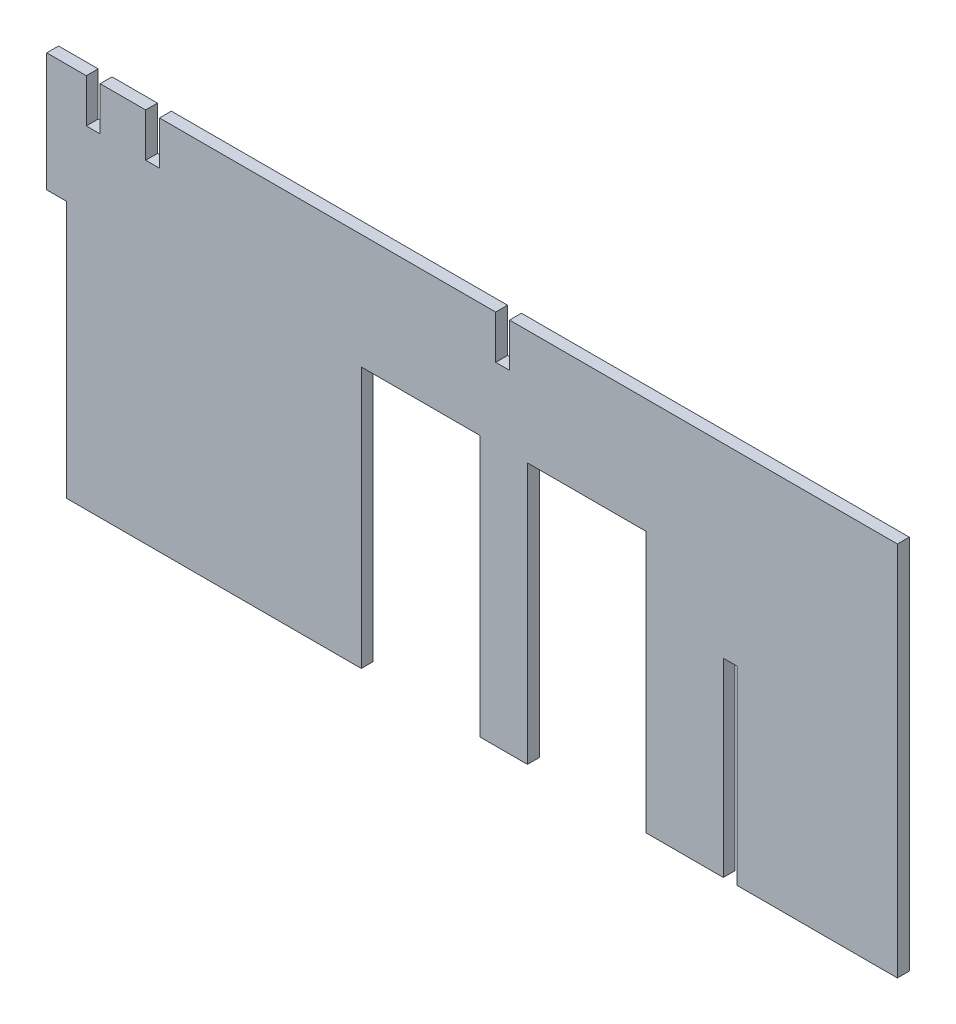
SolidWorks part; units mm, degrees
ref_plane "Plan de face" through (0, 0, 0) normal (0, 0, 1) x (1, 0, 0)
ref_plane "Plan de dessus" through (0, 0, 0) normal (0, 1, 0) x (1, 0, 0)
ref_plane "Plan de droite" through (0, 0, 0) normal (1, 0, 0) x (0, 0, -1)
sketch "Esquisse1" plane through (0, 0, 0) normal (0, 0, 1) x (1, 0, 0)
  line L1 (0, 0) -> (215, 0)
  line L2 (0, 0) -> (0, 95)
  line L3 (0, 95) -> (215, 95)
  line L4 (215, 0) -> (215, 95)
  dimension "D1" = 95
  dimension "D2" = 215
extrude "Extrusion1" add sketch "Esquisse1" along normal blind 3
sketch "Esquisse2" plane through (0, 0, 3) normal (0, 0, 1) x (1, 0, 0)
  line L0 (0, 95) -> (0, 0) construction
  line L1 (0, 65) -> (5, 65)
  line L2 (0, 65) -> (0, 0)
  line L3 (0, 0) -> (5, 0)
  line L4 (5, 65) -> (5, 0)
  line L5 (0, 0) -> (215, 0) construction
  dimension "D1" = 65
  dimension "D2" = 5
extrude "Enlèv. mat.-Extru.1" cut sketch "Esquisse2" against normal blind 3
sketch "Esquisse3" plane through (0, 0, 3) normal (0, 0, 1) x (1, 0, 0)
  line L0 (5, 0) -> (215, 0) construction
  line L1 (79.5, 0) -> (109.5, 0)
  line L2 (79.5, 0) -> (79.5, 66)
  line L3 (79.5, 66) -> (109.5, 66)
  line L4 (109.5, 0) -> (109.5, 66)
  line L6 (121.5, 0) -> (151.5, 0)
  line L7 (121.5, 0) -> (121.5, 66)
  line L8 (121.5, 66) -> (151.5, 66)
  line L9 (151.5, 0) -> (151.5, 66)
  dimension "D1" = 74.5
  dimension "D2" = 30
  dimension "D3" = 12
  dimension "D4" = 30
  dimension "D5" = 66
  dimension "D6" = 66
extrude "Enlèv. mat.-Extru.2" cut sketch "Esquisse3" against normal blind 3
sketch "Esquisse5" plane through (0, 0, 3) normal (0, 0, 1) x (1, 0, 0)
  line L0 (215, 95) -> (0, 95) construction
  line L1 (10, 95) -> (13.5, 95)
  line L2 (10, 95) -> (10, 84)
  line L3 (10, 84) -> (13.5, 84)
  line L4 (13.5, 95) -> (13.5, 84)
  line L5 (0, 95) -> (0, 65) construction
  line L6 (25, 95) -> (28.5, 95)
  line L7 (25, 95) -> (25, 84)
  line L8 (25, 84) -> (28.5, 84)
  line L9 (28.5, 95) -> (28.5, 84)
  line L10 (113.4701, 95) -> (116.9701, 95)
  line L11 (113.4701, 95) -> (113.4701, 84)
  line L12 (113.4701, 84) -> (116.9701, 84)
  line L13 (116.9701, 95) -> (116.9701, 84)
  dimension "D1" = 3.5
  dimension "D2" = 3.5
  dimension "D3" = 3.5
  dimension "D4" = 10
  dimension "D5" = 11.5
  dimension "D6" = 11
  dimension "D7" = 11
  dimension "D8" = 11
extrude "Enlèv. mat.-Extru.4" cut sketch "Esquisse5" against normal blind 3
sketch "Esquisse6" plane through (0, 0, 3) normal (0, 0, 1) x (1, 0, 0)
  line L0 (151.5, 0) -> (215, 0) construction
  line L1 (171, 0) -> (174.5, 0)
  line L2 (171, 0) -> (171, 48)
  line L3 (171, 48) -> (174.5, 48)
  line L4 (174.5, 0) -> (174.5, 48)
  dimension "D1" = 3.5
  dimension "D2" = 19.5
  dimension "D3" = 48
extrude "Enlèv. mat.-Extru.5" cut sketch "Esquisse6" against normal blind 3
